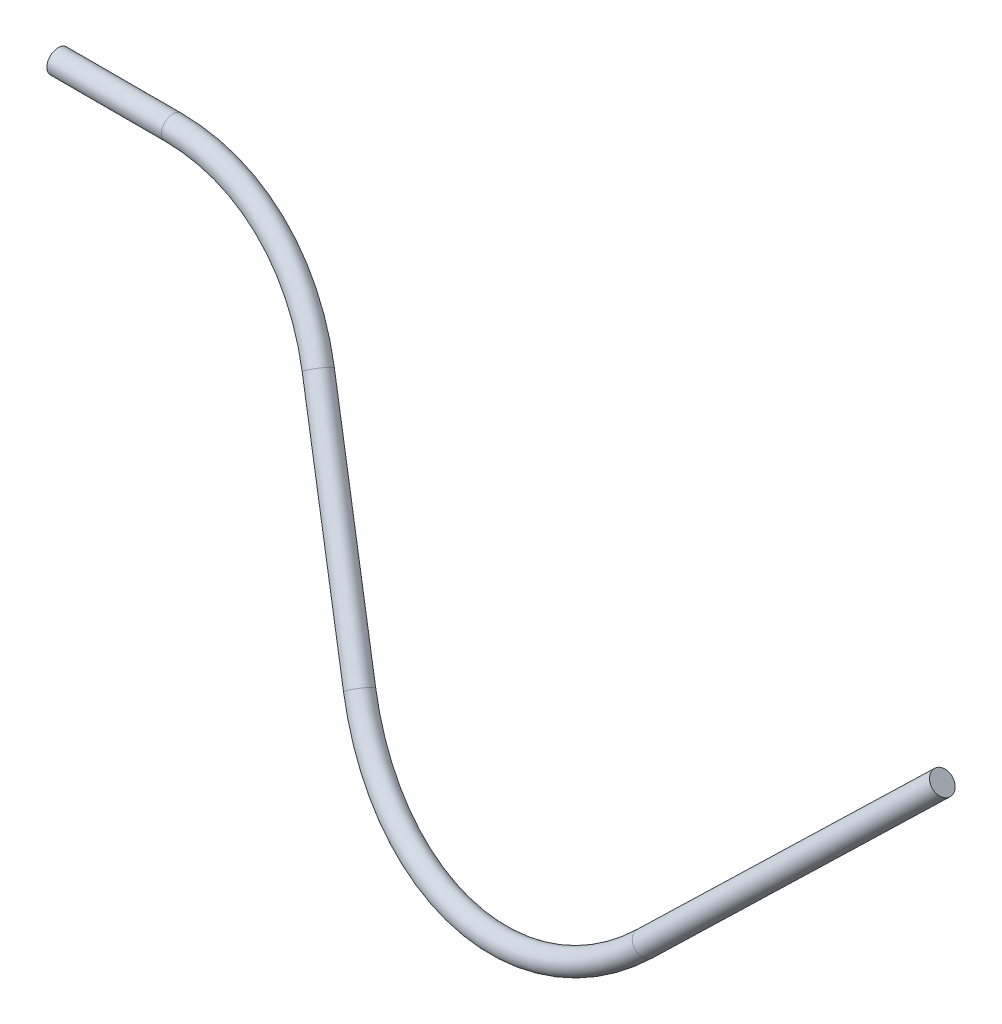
SolidWorks part; units mm, degrees
ref_plane "Vorderansicht" through (0, 0, 0) normal (0, 0, 1) x (1, 0, 0)
ref_plane "Draufsicht" through (0, 0, 0) normal (0, 1, 0) x (1, 0, 0)
ref_plane "Seitenansicht" through (0, 0, 0) normal (1, 0, 0) x (0, 0, -1)
sketch3d "3D-Skizze1"
  line L0 (0, 0, 0) -> (50, 0, 0)
  line L1 (133.3323, -40, 20) -> (188.6109, -114.5347, 57.2673)
  line L2 (188.6109, -114.5347, 57.2673) -> (270.6772, -58.0773, 48.4531) construction
  line L3 (270.6772, -58.0773, 48.4531) -> (339.3667, -121.6759, 83.6237) construction
  line L4 (188.6109, -114.5347, 57.2673) -> (118.4178, -156.1816, 78.0908) construction
  line L5 (50, 0, 0) -> (50, -89.4427, 44.7214) construction
  line L6 (50, -89.4427, 44.7214) -> (133.3323, -40, 20) construction
  line L7 (339.3667, -121.6759, 83.6237) -> (446.1975, -18.8622, 60.8961)
  arc A0 (50, 0, 0) -> (133.3323, -40, 20) centre (50, -89.4427, 44.7214) ccw
  arc A1 (188.6109, -114.5347, 57.2673) -> (339.3667, -121.6759, 83.6237) centre (270.6772, -58.0773, 48.4531) ccw
  point P4 (50, -134.1641, -44.7214)
  point P8 (256.2067, -22.621, 140.8298)
  dimension "D2" = 20
  dimension "D4" = 100
  dimension "D6" = 100
  dimension "D1" = 50
  dimension "D3" = 40
  dimension "D5" = 100
  dimension "D7" = 100
  dimension "D8" = 170
  dimension "D9" = 150
sketch "Skizze1" plane through (0, 0, 0) normal (1, 0, 0) x (0, 0, -1)
  circle A0 centre (0, 0) radius 5
  dimension "D1" = 10
sweep "Austragung1" add profiles "Skizze1" path "3D-Skizze1"
